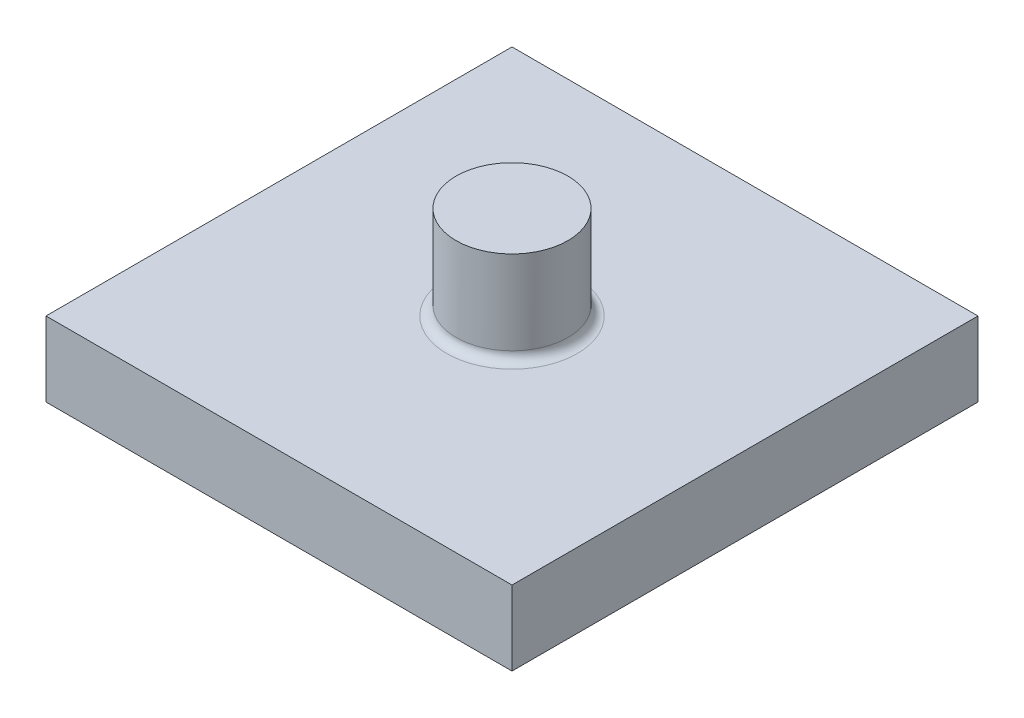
SolidWorks part; units mm, degrees
ref_plane "Alzado" through (0, 0, 0) normal (0, 0, 1) x (1, 0, 0)
ref_plane "Planta" through (0, 0, 0) normal (0, 1, 0) x (1, 0, 0)
ref_plane "Vista lateral" through (0, 0, 0) normal (1, 0, 0) x (0, 0, -1)
sketch "Croquis1" plane through (0, 0, 0) normal (0, 1, 0) x (1, 0, 0)
  line L1 (-12.5, -12.5) -> (12.5, -12.5)
  line L2 (-12.5, -12.5) -> (-12.5, 12.5)
  line L3 (-12.5, 12.5) -> (12.5, 12.5)
  line L4 (12.5, -12.5) -> (12.5, 12.5)
  line L5 (-12.5, -12.5) -> (12.5, 12.5) construction
  line L6 (-12.5, 12.5) -> (12.5, -12.5) construction
  point P0 (0, 0)
  dimension "D1" = 25
  dimension "D2" = 25
extrude "Saliente-Extruir1" add sketch "Croquis1" along normal blind 4
sketch "Croquis2" plane through (0, 4, 0) normal (0, 1, 0) x (1, 0, 0)
  circle A0 centre (0, 0) radius 3
  dimension "D1" = 6
extrude "Saliente-Extruir2" add sketch "Croquis2" along normal blind 5
fillet "Redondeo1" radius 0.5 1 edges at (0, 4, -3)
